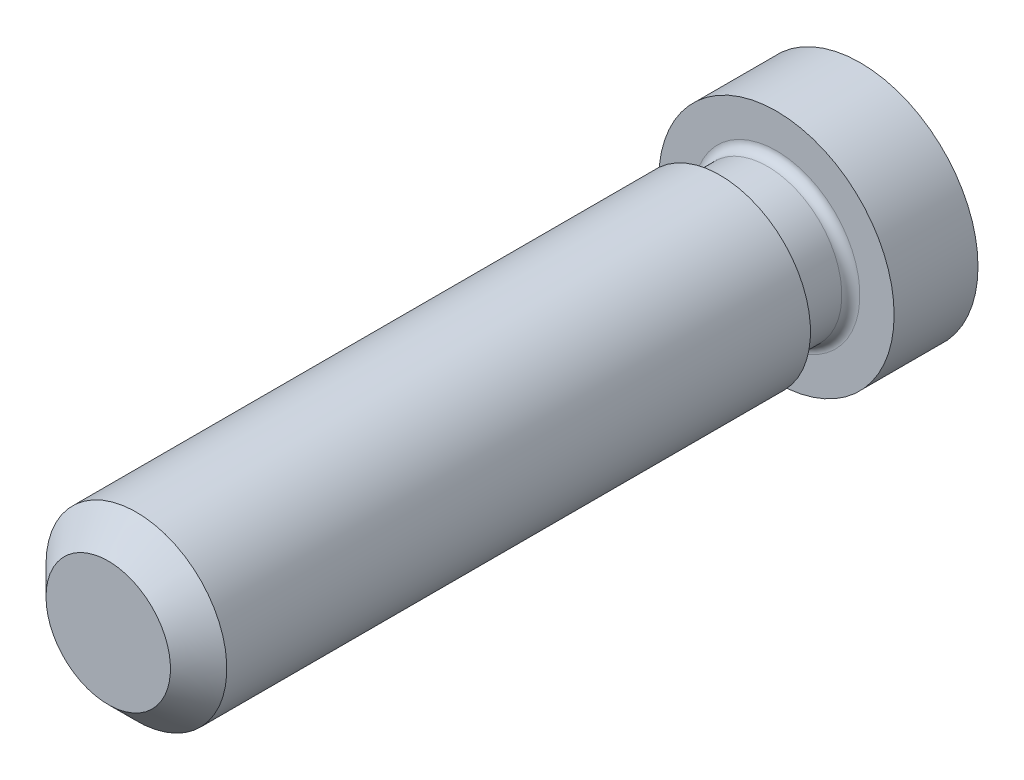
SolidWorks part; units mm, degrees
ref_plane "Спереди" through (0, 0, 0) normal (0, 0, 1) x (1, 0, 0)
ref_plane "Сверху" through (0, 0, 0) normal (0, 1, 0) x (1, 0, 0)
ref_plane "Справа" through (0, 0, 0) normal (1, 0, 0) x (0, 0, -1)
sketch "Эскиз1" plane through (0, 0, 0) normal (1, 0, 0) x (0, 0, -1)
  line L0 (0, 0) -> (-27.5564, 0) construction
  line L1 (0, 0) -> (0, 3.3147)
  line L2 (0, 3.3147) -> (-2.3622, 3.3147)
  line L3 (-2.3622, 3.3147) -> (-2.3622, 2.3495)
  line L4 (-2.6162, 2.0955) -> (-3.9497, 2.0955)
  line L5 (-3.9497, 2.0955) -> (-3.9497, 2.5463)
  line L6 (-3.9497, 2.5463) -> (-20.3898, 2.5463)
  line L7 (-21.1836, 1.7526) -> (-21.1836, 0)
  line L8 (-21.1836, 0) -> (0, 0)
  line L9 (-20.3898, 2.5463) -> (-21.1836, 1.7526)
  arc A0 (-2.3622, 2.3495) -> (-2.6162, 2.0955) centre (-2.6162, 2.3495) cw
  point P9 (-21.1836, 2.5463)
  dimension "D7" = 0.254
  dimension "D1" = 5.0927
  dimension "D2" = 4.191
  dimension "D3" = 6.6294
  dimension "D4" = 2.3622
  dimension "D5" = 1.5875
  dimension "D6" = 21.1836
revolve "Повернуть1" add sketch "Эскиз1" angle 360 about L0
